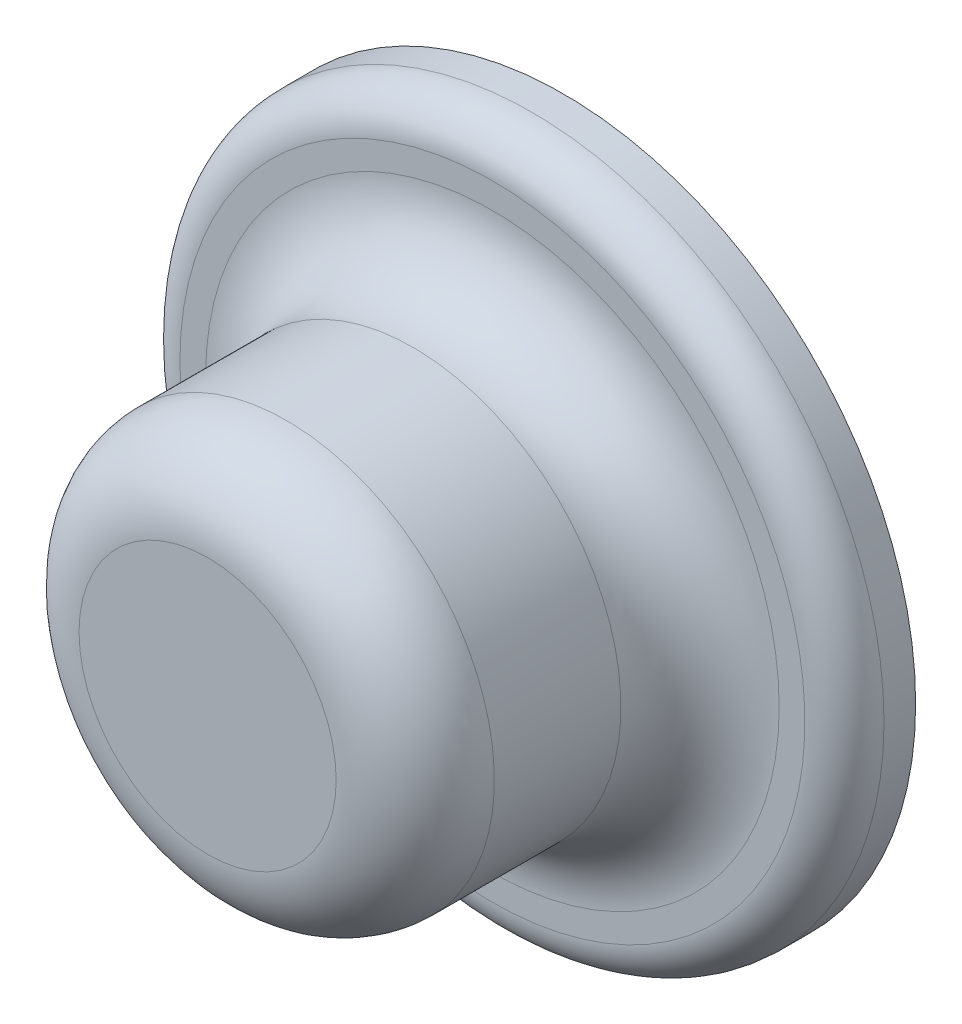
SolidWorks part; units mm, degrees
ref_plane "Plan de face" through (0, 0, 0) normal (0, 0, 1) x (1, 0, 0)
ref_plane "Plan de dessus" through (0, 0, 0) normal (0, 1, 0) x (1, 0, 0)
ref_plane "Plan de droite" through (0, 0, 0) normal (1, 0, 0) x (0, 0, -1)
sketch "Esquisse3" plane through (0, 0, 0) normal (0, 1, 0) x (-1, 0, 0)
  line L0 (88.7781, 70) -> (-88.7781, 70) construction
  line L1 (89, 70) -> (60, 70)
  line L2 (43, 77) -> (43, 96) construction
  line L3 (43, 82) -> (43, 103)
  line L4 (43, 82) -> (60, 82)
  line L5 (60, 82) -> (60, 70)
  line L6 (89, 70) -> (89, 77.9986)
  line L8 (37.5, 103) -> (43, 103)
  line L9 (37.5, 103) -> (37.5, 130)
  line L10 (33.2785, 77.6712) -> (36.6667, 98) construction
  line L11 (0, 48.5389) -> (0, 204.0918) construction
  line L12 (0, 45.9651) -> (0, 60.9651) construction
  line L13 (27.5, 140) -> (0, 140)
  line L14 (0, 140) -> (0, 160)
  line L15 (0, 160) -> (32.5, 160)
  line L16 (52.5, 140) -> (52.5, 107.9986)
  line L17 (72.5, 87.9986) -> (79, 87.9986)
  arc A0 (27.5, 140) -> (37.5, 130) centre (27.5, 130) cw
  arc A1 (32.5, 160) -> (52.5, 140) centre (32.5, 140) cw
  arc A2 (72.5, 87.9986) -> (52.5, 107.9986) centre (72.5, 107.9986) cw
  arc A3 (89, 77.9986) -> (79, 87.9986) centre (79, 77.9986) ccw
  dimension "D1" = 10
  dimension "D2" = 20
  dimension "D10" = 10
  dimension "D3" = 105
  dimension "D4" = 120
  dimension "D5" = 178
  dimension "D6" = 90
  dimension "D7" = 70
  dimension "D8" = 17.9986
  dimension "D9" = 12
  dimension "D11" = 37
revolve "Révolution1" add sketch "Esquisse3" angle 360 about L11
